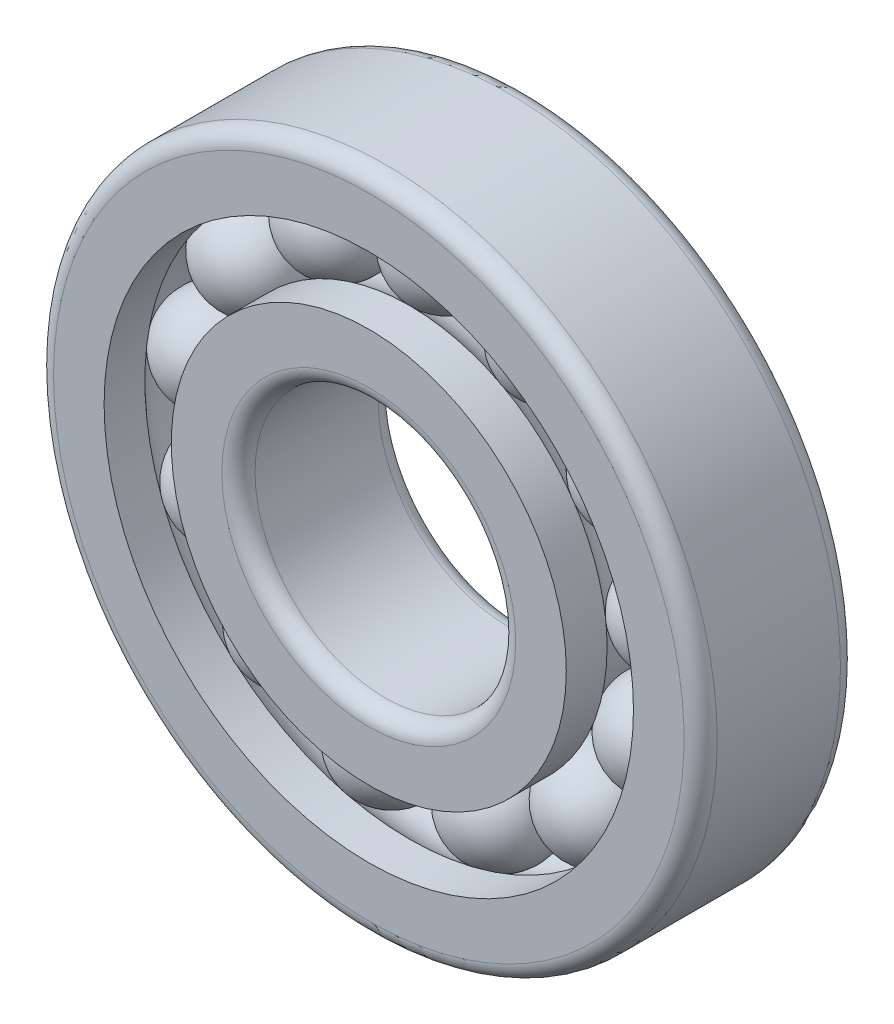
SolidWorks part; units mm, degrees
ref_plane "Front Plane" through (0, 0, 0) normal (0, 0, 1) x (1, 0, 0)
ref_plane "Top Plane" through (0, 0, 0) normal (0, 1, 0) x (1, 0, 0)
ref_plane "Right Plane" through (0, 0, 0) normal (1, 0, 0) x (0, 0, -1)
sketch "BaseSke" plane through (0, 0, 0) normal (1, 0, 0) x (0, 0, -1)
  line L0 (-47.2296, 0) -> (24.6132, 0) construction
  line L1 (-47.2296, 48.75) -> (24.6132, 48.75) construction
  line L2 (0, 129.5214) -> (0, -86.3012) construction
  line L3 (0, 59.375) -> (0, 38.125)
  line L4 (-16.5, 70) -> (16.5, 70) construction
  line L5 (-16.5, 27.5) -> (16.5, 27.5) construction
  arc A0 (0, 59.375) -> (0, 38.125) centre (0, 48.75) ccw
  dimension "Ball_diameter" = 21.25
  dimension "D1" = 48.75
  dimension "Bearing_Thickness" = 33
  dimension "Bearing_Outside_Diameter" = 140
  dimension "Bearing_Inside_Diameter" = 55
revolve "Ball" add sketch "BaseSke" angle 360 about L3
sketch "OuterRaceSke" plane through (0, 0, 0) normal (1, 0, 0) x (0, 0, -1)
  line L0 (0, 0) -> (0, 87.5396) construction
  line L1 (-16.5, 70) -> (16.5, 70)
  line L2 (-16.5, 70) -> (-16.5, 55.8333)
  line L3 (-16.5, 55.8333) -> (-7.906, 55.8333)
  line L4 (16.5, 70) -> (16.5, 55.8333)
  line L5 (-50.3916, 0) -> (55.2197, 0) construction
  line L6 (-47.2296, 48.75) -> (24.6132, 48.75) construction
  line L7 (7.906, 55.8333) -> (16.5, 55.8333)
  arc A0 (7.906, 55.8333) -> (-7.906, 55.8333) centre (0, 48.75) ccw
  dimension "D4" = 21.23
  dimension "D2" = 111.6667
revolve "OuterRace" add sketch "OuterRaceSke" angle 360 about L5
sketch "InnerRaceSke" plane through (0, 0, 0) normal (1, 0, 0) x (0, 0, -1)
  line L0 (-70.8626, 0) -> (113.5527, 0) construction
  line L1 (0, 58.441) -> (0, -70.8113) construction
  line L2 (-16.5, 27.5) -> (16.5, 27.5)
  line L3 (-16.5, 27.5) -> (-16.5, 41.6667)
  line L4 (-16.5, 41.6667) -> (-7.906, 41.6667)
  line L5 (16.5, 27.5) -> (16.5, 41.6667)
  line L6 (0, 129.5214) -> (0, -86.3012) construction
  line L7 (7.906, 41.6667) -> (16.5, 41.6667)
  arc A0 (-7.906, 41.6667) -> (7.906, 41.6667) centre (0, 48.75) ccw
  arc A1 (0, 59.375) -> (0, 38.125) centre (0, 48.75) ccw construction
  dimension "D2" = 21.23
  dimension "D1" = 83.3333
revolve "InnerRace" add sketch "InnerRaceSke" angle 360 about L0
fillet "Fillet1" radius 3.5 4 edges at (27.5, 0, -16.5) (27.5, 0, 16.5) (70, 0, -16.5) (70, 0, 16.5)
pattern_circular "CirPatternBall" count 13 over 360 about axis through (0, 0, 0) along (0, 0, 1) of "Ball"
sketch "SimplifiedSke" plane through (0, 0, 0) normal (1, 0, 0) x (0, 0, -1)
  line L0 (37.5911, 0) -> (-37.5911, 0) construction
  circle A0 centre (0, 48.75) radius 10.625
  arc A1 (0, 59.375) -> (0, 38.125) centre (0, 48.75) ccw construction
revolve "Simplified" [suppressed] add sketch "SimplifiedSke" angle 360 about L0
equation "\"D1@BaseSke\" =  (\"Bearing_Outside_Diameter@BaseSke\"  +  \"Bearing_Inside_Diameter@BaseSke\"  )  / 4"
equation "\"Ball_diameter@BaseSke\" =  ( \"Bearing_Outside_Diameter@BaseSke\" - \"Bearing_Inside_Diameter@BaseSke\" ) / 4 "
equation "\"D2@OuterRaceSke\" = \"Bearing_Outside_Diameter@BaseSke\" -  ( \"Bearing_Outside_Diameter@BaseSke\" - \"Bearing_Inside_Diameter@BaseSke\" )  / 3"
equation "\"D4@OuterRaceSke\" = (  \"Bearing_Outside_Diameter@BaseSke\" - \"Bearing_Inside_Diameter@BaseSke\" ) / 4 -0.02"
equation "\"D1@InnerRaceSke\" = \"Bearing_Inside_Diameter@BaseSke\" +  ( \"Bearing_Outside_Diameter@BaseSke\" - \"Bearing_Inside_Diameter@BaseSke\" )  / 3"
equation "\"D2@InnerRaceSke\" = \"D4@OuterRaceSke\""
equation "\"D1@CirPatternBall\" = int( \"D1@BaseSke\"* pi  * 2 / \"Ball_diameter@BaseSke\" ) -1"
